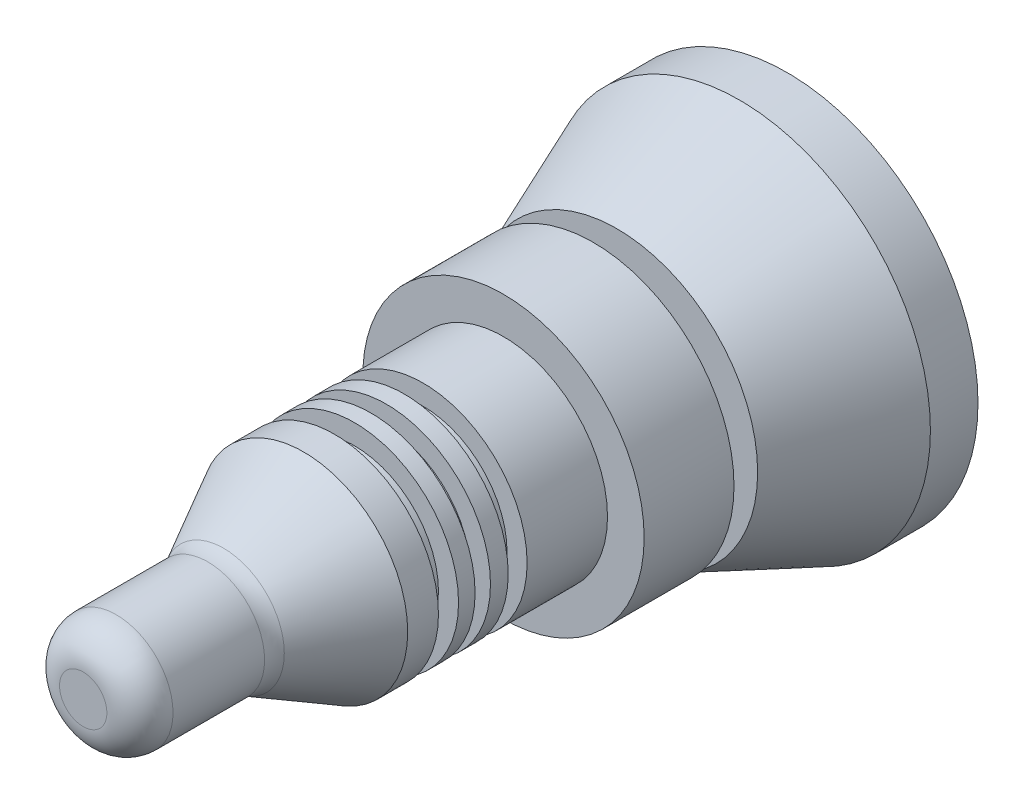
SolidWorks part; units mm, degrees
ref_plane "Plane1" through (0, 0, 0) normal (0, 0, 1) x (1, 0, 0)
ref_plane "Plane2" through (0, 0, 0) normal (0, 1, 0) x (1, 0, 0)
ref_plane "Plane3" through (0, 0, 0) normal (1, 0, 0) x (0, 0, -1)
sketch "Sketch2" plane through (0, 0, 0) normal (1, 0, 0) x (0, 0, -1)
  line L0 (0, 0) -> (0, 7.1576)
  line L1 (10, 17.1576) -> (37.6834, 17.1576)
  line L2 (42.4386, 18.3606) -> (66.6645, 31.4556)
  line L3 (66.6645, 31.4556) -> (75.9582, 31.4556)
  line L4 (75.9582, 31.4556) -> (75.9582, 25.379)
  line L5 (75.9582, 25.379) -> (82.0349, 25.379)
  line L6 (82.0349, 25.379) -> (82.0349, 31.4556)
  line L7 (82.0349, 31.4556) -> (87.0392, 31.4556)
  line L8 (87.0392, 31.4556) -> (87.0392, 25.379)
  line L9 (87.0392, 25.379) -> (91.686, 25.379)
  line L10 (91.686, 25.379) -> (91.686, 31.4556)
  line L11 (91.686, 31.4556) -> (97.0478, 31.4556)
  line L12 (97.0478, 31.4556) -> (97.0478, 25.379)
  line L13 (97.0478, 25.379) -> (102.767, 25.379)
  line L14 (102.767, 25.379) -> (102.767, 31.4556)
  line L15 (102.767, 31.4556) -> (127.0736, 31.4556)
  line L16 (127.0736, 31.4556) -> (127.0736, 42.5366)
  line L17 (127.0736, 42.5366) -> (154.2398, 42.5366)
  line L18 (154.2398, 42.5366) -> (154.2398, 22.8768)
  line L19 (154.2398, 22.8768) -> (161.3888, 22.8768)
  line L20 (161.3888, 22.8768) -> (161.3888, 42.5366)
  line L21 (161.3888, 42.5366) -> (198.4471, 57.7128)
  line L22 (198.4471, 57.7128) -> (212.8364, 57.7128)
  line L23 (212.8364, 57.7128) -> (212.8364, 0)
  line L24 (212.8364, 0) -> (0, 0)
  line L25 (-62.7325, 0) -> (253.3876, 0) construction
  arc A0 (10, 17.1576) -> (0, 7.1576) centre (10, 7.1576) ccw
  arc A1 (37.6834, 17.1576) -> (42.4386, 18.3606) centre (37.6834, 27.1576) ccw
  dimension "D1" = 10
revolve "Base-Revolve" add sketch "Sketch2" angle 360 about L25
